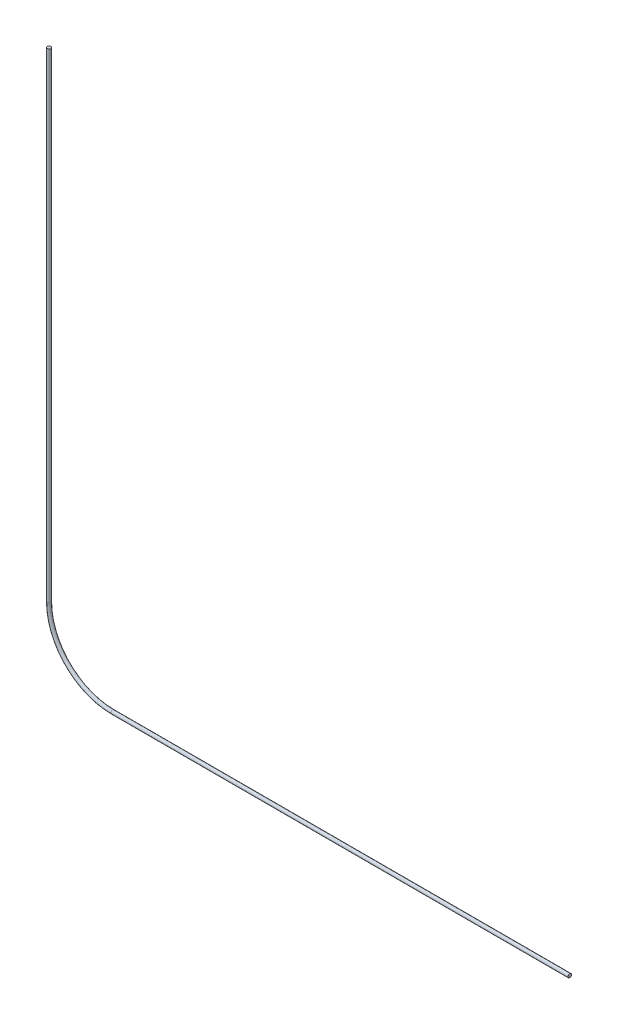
SolidWorks part; units mm, degrees
ref_plane "Front Plane" through (0, 0, 0) normal (0, 0, 1) x (1, 0, 0)
ref_plane "Top Plane" through (0, 0, 0) normal (0, 1, 0) x (1, 0, 0)
ref_plane "Right Plane" through (0, 0, 0) normal (1, 0, 0) x (0, 0, -1)
sketch "Sketch1" plane through (0, 0, 0) normal (0, 0, 1) x (1, 0, 0)
  line L0 (0, 0) -> (-45.7, 0)
  line L1 (-52.0625, 6.3625) -> (-52.0625, 54.3503)
  arc A0 (-45.7, 0) -> (-52.0625, 6.3625) centre (-45.7, 6.3625) cw
  point P2 (0, 0)
  point P6 (0, 0)
  point P7 (0, 0)
  point P8 (0, 0)
  point P9 (0, 0)
  point P11 (-60.2608, 9.1622)
  point P12 (0, 0)
  point P13 (0, 0)
  point P15 (0, 0)
  dimension "D2" = 45.7
sketch "Sketch2" plane through (0, 0, 0) normal (1, 0, 0) x (0, 0, -1)
  circle A0 centre (0, 0) radius 0.18
  dimension "D1" = 0.36
sweep "Sweep1" add profiles "Sketch2" path "Sketch1"
